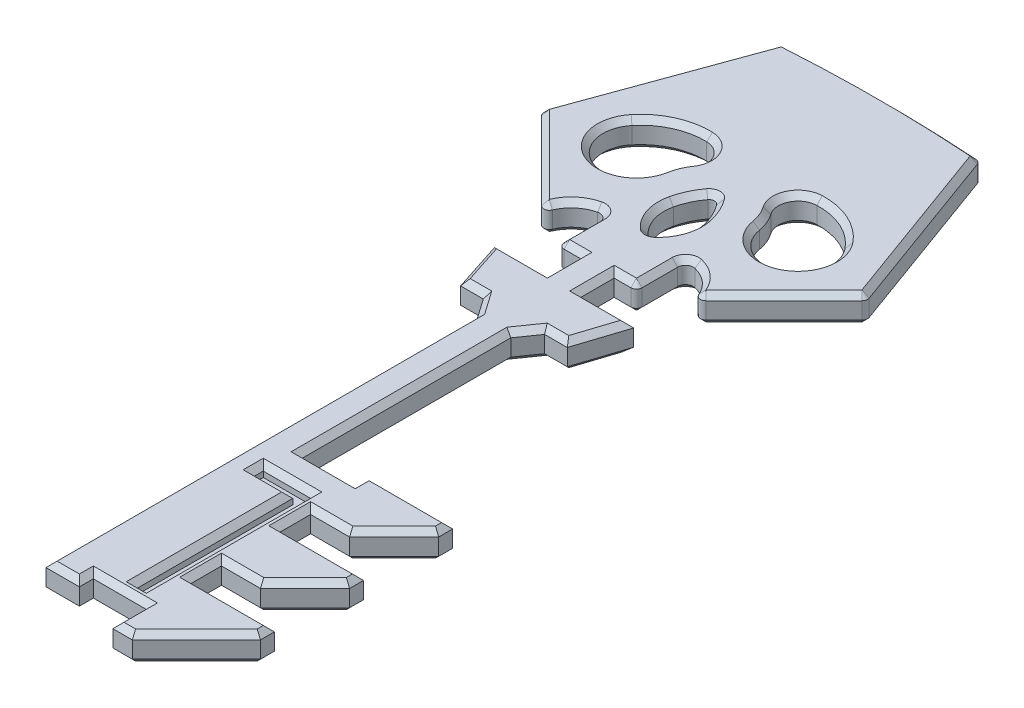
SolidWorks part; units mm, degrees
ref_plane "Front Plane" through (0, 0, 0) normal (0, 0, 1) x (1, 0, 0)
ref_plane "Top Plane" through (0, 0, 0) normal (0, 1, 0) x (1, 0, 0)
ref_plane "Right Plane" through (0, 0, 0) normal (1, 0, 0) x (0, 0, -1)
sketch "Sketch1" plane through (0, 0, 0) normal (0, 1, 0) x (1, 0, 0)
  line L0 (-23.0659, 90.1319) -> (29.6008, 90.1319) construction
  line L1 (0, 0) -> (0, 98.3356)
  line L2 (0, 98.3356) -> (-3.175, 102.87)
  line L3 (-3.175, 102.87) -> (-8.3512, 102.87)
  line L4 (-8.3512, 102.87) -> (-12.065, 114.3)
  line L5 (-12.065, 114.3) -> (0, 114.3)
  line L6 (0, 114.3) -> (0, 121.92)
  line L7 (0, 121.92) -> (-3.81, 121.92)
  line L8 (-5.08, 123.19) -> (-5.08, 131.318)
  line L9 (-14.9446, 127.9221) -> (-32.7246, 145.7021)
  line L10 (-33.02, 147.0345) -> (-18.9216, 185.7695)
  line L11 (0, 0) -> (7.62, 0) construction
  line L12 (3.81, 133.6255) -> (3.81, 186.1943) construction
  line L13 (7.62, 98.3356) -> (10.795, 102.87)
  line L14 (10.795, 102.87) -> (15.9712, 102.87)
  line L15 (15.9712, 102.87) -> (19.685, 114.3)
  line L16 (19.685, 114.3) -> (7.62, 114.3)
  line L17 (7.62, 114.3) -> (7.62, 121.92)
  line L18 (7.62, 121.92) -> (11.43, 121.92)
  line L19 (12.7, 123.19) -> (12.7, 131.318)
  line L20 (22.5646, 127.9221) -> (40.3446, 145.7021)
  line L21 (40.64, 147.0345) -> (26.5416, 185.7695)
  line L22 (7.62, 98.3356) -> (7.62, 50.8)
  line L23 (7.62, 50.8) -> (19.685, 50.8)
  line L24 (19.685, 50.8) -> (19.685, 53.975)
  line L25 (19.685, 53.975) -> (38.735, 53.975)
  line L26 (38.735, 53.975) -> (38.735, 50.8)
  line L27 (38.735, 50.8) -> (28.575, 40.64)
  line L28 (28.575, 40.64) -> (19.685, 40.64)
  line L29 (19.685, 40.64) -> (19.685, 33.655)
  line L30 (19.685, 33.655) -> (38.735, 33.655)
  line L31 (38.735, 33.655) -> (38.735, 30.48)
  line L32 (38.735, 30.48) -> (28.575, 20.32)
  line L33 (28.575, 20.32) -> (19.685, 20.32)
  line L34 (19.685, 20.32) -> (19.685, 13.335)
  line L35 (19.685, 13.335) -> (38.735, 13.335)
  line L36 (38.735, 13.335) -> (38.735, 10.16)
  line L37 (38.735, 10.16) -> (24.13, -4.445)
  line L38 (24.13, -4.445) -> (19.685, -4.445)
  line L39 (19.685, -4.445) -> (19.685, 3.175)
  line L40 (19.685, 3.175) -> (7.62, 3.175)
  line L41 (7.62, 3.175) -> (7.62, 0)
  line L42 (7.62, 0) -> (0, 0)
  arc A0 (-17.813, 186.6023) -> (25.433, 186.6023) centre (3.81, -136.525) cw
  arc A1 (-5.08, 131.318) -> (-7.2662, 133.0485) centre (-6.858, 131.318) ccw
  arc A2 (-12.8781, 128.3225) -> (-7.2662, 133.0485) centre (-5.4001, 125.1376) cw
  arc A3 (12.7, 131.318) -> (14.8862, 133.0485) centre (14.478, 131.318) cw
  arc A4 (20.4981, 128.3225) -> (14.8862, 133.0485) centre (13.0201, 125.1376) ccw
  arc A5 (-5.262, 152.3718) -> (-8.7489, 159.3828) centre (-8.89, 154.94) ccw
  arc A6 (-5.262, 152.3718) -> (-7.0931, 147.9463) centre (3.5489, 146.1348) ccw
  arc A7 (-7.0931, 147.9463) -> (-20.4876, 154.0685) centre (-14.605, 149.225) cw
  arc A8 (-20.4876, 154.0685) -> (-8.7489, 159.3828) centre (-9.2126, 144.7851) cw
  arc A9 (2.9514, 134.3192) -> (0.3175, 142.7073) centre (8.89, 140.7915) cw
  arc A10 (0.3175, 142.7073) -> (2.7942, 148.0822) centre (14.047, 139.639) cw
  arc A11 (4.6686, 134.3192) -> (7.3025, 142.7073) centre (-1.27, 140.7915) ccw
  arc A12 (7.3025, 142.7073) -> (4.8258, 148.0822) centre (-6.427, 139.639) ccw
  arc A13 (14.7131, 147.9463) -> (28.1076, 154.0685) centre (22.225, 149.225) ccw
  arc A14 (12.882, 152.3718) -> (14.7131, 147.9463) centre (4.0711, 146.1348) cw
  arc A15 (12.882, 152.3718) -> (16.3689, 159.3828) centre (16.51, 154.94) cw
  arc A16 (28.1076, 154.0685) -> (16.3689, 159.3828) centre (16.8326, 144.7851) ccw
  arc A17 (4.6686, 134.3192) -> (2.9514, 134.3192) centre (3.81, 135.255) cw
  arc A18 (2.7942, 148.0822) -> (4.8258, 148.0822) centre (3.81, 147.32) cw
  arc A19 (11.43, 121.92) -> (12.7, 123.19) centre (11.43, 123.19) ccw
  arc A20 (-3.81, 121.92) -> (-5.08, 123.19) centre (-3.81, 123.19) cw
  arc A21 (-14.9446, 127.9221) -> (-12.8781, 128.3225) centre (-14.0466, 128.8202) ccw
  arc A22 (22.5646, 127.9221) -> (20.4981, 128.3225) centre (21.6666, 128.8202) cw
  arc A23 (26.5416, 185.7695) -> (25.433, 186.6023) centre (25.3482, 185.3352) ccw
  arc A24 (40.3446, 145.7021) -> (40.64, 147.0345) centre (39.4466, 146.6002) ccw
  arc A25 (-32.7246, 145.7021) -> (-33.02, 147.0345) centre (-31.8266, 146.6002) cw
  arc A26 (-18.9216, 185.7695) -> (-17.813, 186.6023) centre (-17.7282, 185.3352) cw
  point P59 (0, 0)
  point P84 (3.81, 149.2888)
  point P87 (12.7, 121.92)
  point P90 (-5.08, 121.92)
  point P93 (-13.4285, 126.4061)
  point P96 (21.0485, 126.4061)
  point P99 (26.259, 186.546)
  point P102 (40.9167, 146.2742)
  point P105 (-33.2967, 146.2742)
  point P108 (-18.639, 186.546)
  point P109 (-5.7631, 102.87)
  point P110 (1.27, 145.5265)
  point P111 (9.525, 121.92)
  dimension "D1" = 1.27
  dimension "D26" = 14.605
  dimension "D27" = 7.62
  dimension "D28" = 10.795
  dimension "D29" = 4.445
  dimension "D31" = 323.85
  dimension "D36" = 136.525
  dimension "D41" = 10.16
  dimension "D43" = 8.128
  dimension "D44" = 1.778
  dimension "D2" = 7.62
  dimension "D3" = 3.175
  dimension "D4" = 3.175
  dimension "D5" = 3.175
  dimension "D6" = 3.175
  dimension "D7" = 12.065
  dimension "D8" = 19.05
  dimension "D9" = 45
  dimension "D10" = 10.16
  dimension "D11" = 6.985
  dimension "D12" = 6.985
  dimension "D13" = 10.16
  dimension "D14" = 14.605
  dimension "D15" = 3.175
  dimension "D16" = 19.05
  dimension "D17" = 19.05
  dimension "D18" = 53.975
  dimension "D19" = 45
  dimension "D20" = 11.43
  dimension "D21" = 18
  dimension "D22" = 31.75
  dimension "D23" = 13.97
  dimension "D24" = 35
  dimension "D25" = 114.3
  dimension "D30" = 154.94
  dimension "D32" = 38.735
  dimension "D33" = 17.78
  dimension "D34" = 20
  dimension "D35" = 73.66
  dimension "D37" = 18.415
  dimension "D38" = 12.7
  dimension "D39" = 149.225
  dimension "D40" = 2.54
  dimension "D42" = 6.985
  dimension "D45" = 8.128
  dimension "D46" = 3.81
  dimension "D47" = 7.62
  dimension "D48" = 20.955
  dimension "D49" = 33.02
extrude "Boss-Extrude1" add sketch "Sketch1" against normal mid plane 6.35
sketch "Sketch2" plane through (0, 3.175, 0) normal (0, 1, 0) x (1, 0, 0)
  line L0 (-22.6783, 89.4637) -> (29.9884, 89.4637) construction
  line L1 (5.715, 43.815) -> (5.715, 41.783)
  line L2 (5.715, 41.783) -> (14.478, 41.783)
  line L3 (14.478, 41.783) -> (14.478, 6.35)
  line L4 (14.478, 6.35) -> (16.51, 6.35)
  line L5 (16.51, 6.35) -> (16.51, 43.815)
  line L6 (16.51, 43.815) -> (5.715, 43.815)
  line L7 (19.685, 33.655) -> (19.685, 40.64) construction
  line L8 (19.685, 50.8) -> (7.62, 50.8) construction
  line L9 (7.62, 3.175) -> (19.685, 3.175) construction
  dimension "D1" = 3.175
  dimension "D2" = 6.985
  dimension "D3" = 10.795
  dimension "D4" = 2.032
  dimension "D5" = 2.032
  dimension "D6" = 3.175
extrude "Cut-Extrude1" cut sketch "Sketch2" against normal blind 2.54
chamfer "Chamfer1" distance 1.27 angle 45 140 edges at (7.62, -3.175, -1.5875) (13.6525, -3.175, -3.175) (19.685, -3.175, 0.635) (21.9075, -3.175, 4.445) (31.4325, -3.175, -2.8575) (38.735, -3.175, -11.7475) (29.21, -3.175, -13.335) (19.685, -3.175, -16.8275) (24.13, -3.175, -20.32) (33.655, -3.175, -25.4) (38.735, -3.175, -32.0675) (29.21, -3.175, -33.655) (19.685, -3.175, -37.1475) (24.13, -3.175, -40.64) (33.655, -3.175, -45.72) (38.735, -3.175, -52.3875) (29.21, -3.175, -53.975) (19.685, -3.175, -52.3875) (13.6525, -3.175, -50.8) (7.62, -3.175, -74.5678) (9.2075, -3.175, -100.6028) (13.3831, -3.175, -102.87) (17.8281, -3.175, -108.585) (13.6525, -3.175, -114.3) (7.62, -3.175, -118.11) (9.525, -3.175, -121.92) (12.328, -3.175, -122.292) (12.7, -3.175, -127.254) (13.3745, -3.175, -132.7121) (18.2558, -3.175, -131.3547) (21.425, -3.175, -127.5733) (31.4546, -3.175, -136.8121) (40.6865, -3.175, -146.3253) (33.5908, -3.175, -166.402) (26.111, -3.175, -186.3506) (3.81, -3.175, -187.325) (-18.491, -3.175, -186.3506) (-25.9708, -3.175, -166.402) (-33.0665, -3.175, -146.3253) (-23.8346, -3.175, -136.8121) (-13.805, -3.175, -127.5733) (-10.6358, -3.175, -131.3547) (-5.7545, -3.175, -132.7121) (-5.08, -3.175, -127.254) (-4.708, -3.175, -122.292) (-1.905, -3.175, -121.92) (0, -3.175, -118.11) (-6.0325, -3.175, -114.3) (-10.2081, -3.175, -108.585) (-5.7631, -3.175, -102.87) (-1.5875, -3.175, -100.6028) (0, -3.175, -49.1678) (3.81, -3.175, 0) (-17.7727, -3.175, -142.2946) (-15.236, -3.175, -158.0902) (-4.9101, -3.175, -156.9194) (-6.4261, -3.175, -150.2619) (3.81, -3.175, -148.59) (6.35, -3.175, -145.5265) (7.1105, -3.175, -138.16) (3.81, -3.175, -133.985) (0.5095, -3.175, -138.16) (1.27, -3.175, -145.5265) (12.5301, -3.175, -156.9194) (22.856, -3.175, -158.0902) (25.3927, -3.175, -142.2946) (14.0461, -3.175, -150.2619) (0, 3.175, -49.1678) (-1.5875, 3.175, -100.6028) (-5.7631, 3.175, -102.87) (-10.2081, 3.175, -108.585) (-6.0325, 3.175, -114.3) (0, 3.175, -118.11) (-1.905, 3.175, -121.92) (-4.708, 3.175, -122.292) (-5.08, 3.175, -127.254) (-5.7545, 3.175, -132.7121) (-10.6358, 3.175, -131.3547) (-13.805, 3.175, -127.5733) (-23.8346, 3.175, -136.8121) (-33.0665, 3.175, -146.3253) (-25.9708, 3.175, -166.402) (-18.491, 3.175, -186.3506) (3.81, 3.175, -187.325) (26.111, 3.175, -186.3506) (33.5908, 3.175, -166.402) (40.6865, 3.175, -146.3253) (31.4546, 3.175, -136.8121) (21.425, 3.175, -127.5733) (18.2558, 3.175, -131.3547) (13.3745, 3.175, -132.7121) (12.7, 3.175, -127.254) (12.328, 3.175, -122.292) (9.525, 3.175, -121.92) (7.62, 3.175, -118.11) (13.6525, 3.175, -114.3) (17.8281, 3.175, -108.585) (13.3831, 3.175, -102.87) (9.2075, 3.175, -100.6028) (7.62, 3.175, -74.5678) (13.6525, 3.175, -50.8) (19.685, 3.175, -52.3875) (29.21, 3.175, -53.975) (38.735, 3.175, -52.3875) (33.655, 3.175, -45.72) (24.13, 3.175, -40.64) (19.685, 3.175, -37.1475) (29.21, 3.175, -33.655) (38.735, 3.175, -32.0675) (33.655, 3.175, -25.4) (24.13, 3.175, -20.32) (19.685, 3.175, -16.8275) (29.21, 3.175, -13.335) (38.735, 3.175, -11.7475) (31.4325, 3.175, -2.8575) (21.9075, 3.175, 4.445) (19.685, 3.175, 0.635) (13.6525, 3.175, -3.175) (7.62, 3.175, -1.5875) (3.81, 3.175, 0) (-15.236, 3.175, -158.0902) (-17.7727, 3.175, -142.2946) (-6.4261, 3.175, -150.2619) (-4.9101, 3.175, -156.9194) (3.81, 3.175, -133.985) (7.1105, 3.175, -138.16) (6.35, 3.175, -145.5265) (3.81, 3.175, -148.59) (1.27, 3.175, -145.5265) (0.5095, 3.175, -138.16) (22.856, 3.175, -158.0902) (12.5301, 3.175, -156.9194) (14.0461, 3.175, -150.2619) (25.3927, 3.175, -142.2946) (10.0965, 3.175, -41.783) (14.478, 3.175, -24.0665) (15.494, 3.175, -6.35) (16.51, 3.175, -25.0825) (11.1125, 3.175, -43.815) (5.715, 3.175, -42.799)
